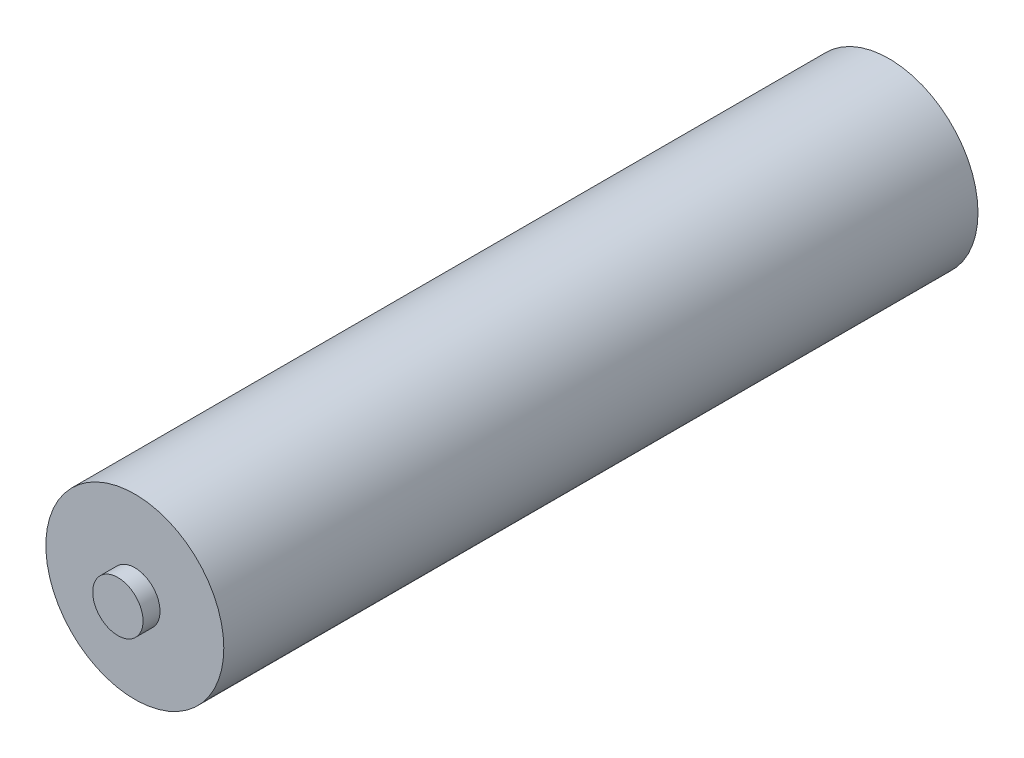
SolidWorks part; units mm, degrees
ref_plane "정면" through (0, 0, 0) normal (0, 0, 1) x (1, 0, 0)
ref_plane "윗면" through (0, 0, 0) normal (0, 1, 0) x (1, 0, 0)
ref_plane "우측면" through (0, 0, 0) normal (1, 0, 0) x (0, 0, -1)
sketch "스케치1" plane through (0, 0, 0) normal (0, 0, 1) x (1, 0, 0)
  circle A0 centre (0, 0) radius 5.25
  dimension "D1" = 10.5
extrude "보스-돌출1" add sketch "스케치1" along normal blind 44.5
sketch "스케치2" plane through (0, 0, 44.5) normal (0, 0, 1) x (1, 0, 0)
  circle A0 centre (0, 0) radius 1.4847
extrude "보스-돌출2" add sketch "스케치2" along normal blind 1
